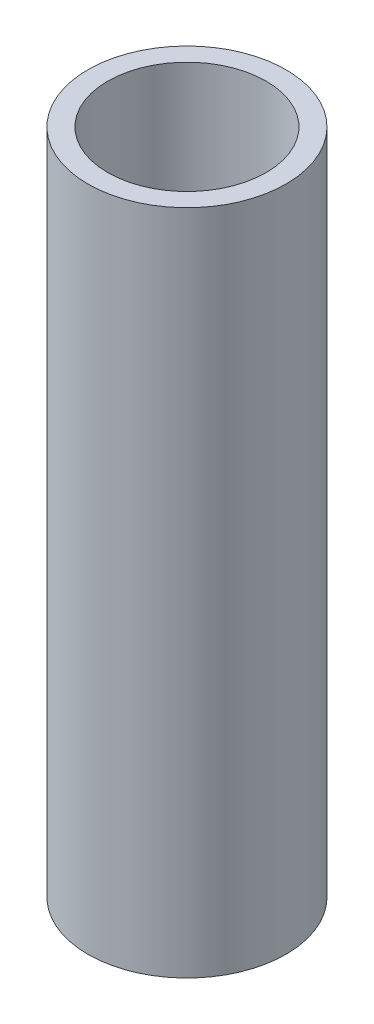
SolidWorks part; units mm, degrees
ref_plane "Front Plane" through (0, 0, 0) normal (0, 0, 1) x (1, 0, 0)
ref_plane "Top Plane" through (0, 0, 0) normal (0, 1, 0) x (1, 0, 0)
ref_plane "Right Plane" through (0, 0, 0) normal (1, 0, 0) x (0, 0, -1)
sketch "Sketch1" plane through (0, 0, 0) normal (0, 1, 0) x (1, 0, 0)
  circle A0 centre (0, 0) radius 12.7
  circle A1 centre (0, 0) radius 15.875
  dimension "D1" = 25.4
  dimension "D2" = 31.75
extrude "Boss-Extrude1" add sketch "Sketch1" along normal mid plane 106.934
